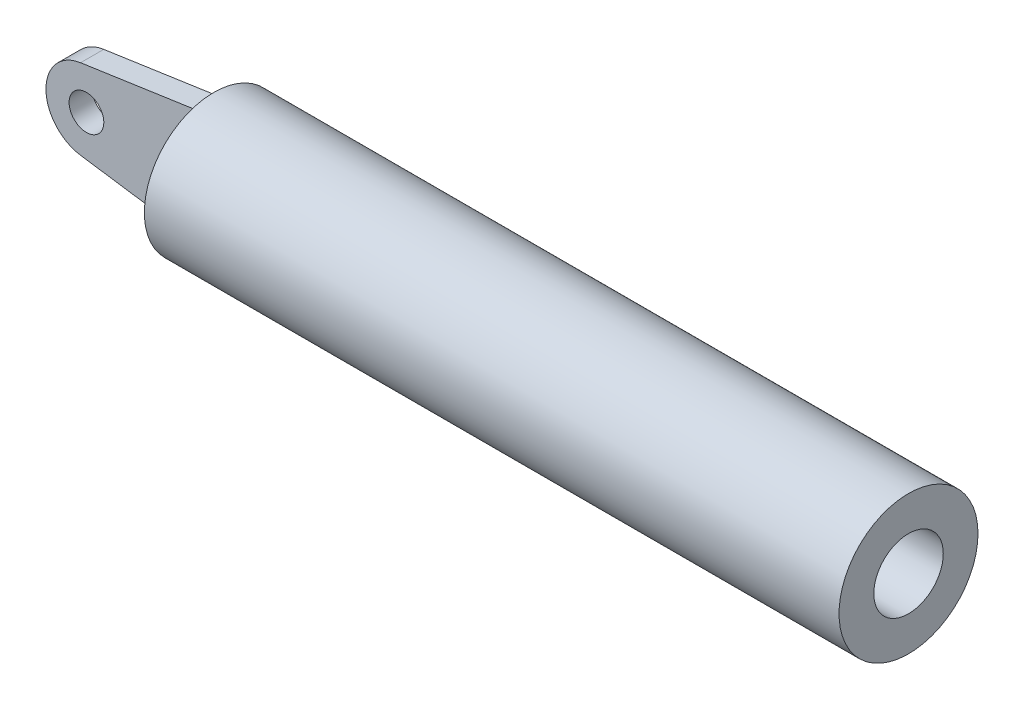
SolidWorks part; units mm, degrees
ref_plane "Front Plane" through (0, 0, 0) normal (0, 0, 1) x (1, 0, 0)
ref_plane "Top Plane" through (0, 0, 0) normal (0, 1, 0) x (1, 0, 0)
ref_plane "Right Plane" through (0, 0, 0) normal (1, 0, 0) x (0, 0, -1)
sketch "Sketch1" plane through (0, 0, 0) normal (1, 0, 0) x (0, 0, -1)
  circle A0 centre (0, 0) radius 60
  dimension "D1" = 120
extrude "Boss-Extrude1" add sketch "Sketch1" along normal blind 600
sketch "Sketch2" plane through (600, 0, 0) normal (1, 0, 0) x (0, 0, -1)
  circle A0 centre (0, 0) radius 30
  dimension "D1" = 60
extrude "Cut-Extrude1" cut sketch "Sketch2" against normal blind 580
sketch "Sketch3" plane through (0, 0, 0) normal (0, 0, 1) x (1, 0, 0)
  line L0 (0, -50) -> (0, 50)
  line L1 (0, 60) -> (0, -60) construction
  line L2 (0, 50) -> (-105.0657, 34.6315)
  line L3 (0, 0) -> (-100, 0) construction
  line L4 (0, -50) -> (-105.0657, -34.6315)
  arc A0 (-105.0657, 34.6315) -> (-105.0657, -34.6315) centre (-100, 0) ccw
  circle A1 centre (-100, 0) radius 15
  dimension "D3" = 35
  dimension "D4" = 30
  dimension "D1" = 100
  dimension "D2" = 100
extrude "Boss-Extrude2" add sketch "Sketch3" along normal mid plane 20
